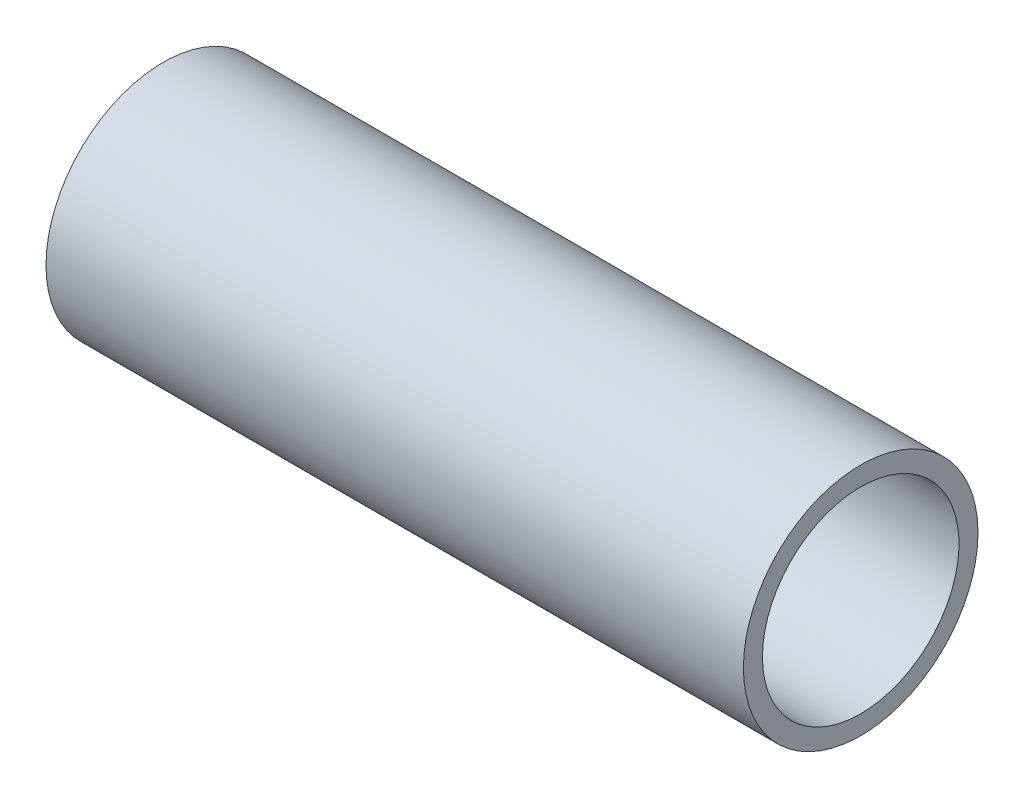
SolidWorks part; units mm, degrees
ref_plane "Plan de face" through (0, 0, 0) normal (0, 0, 1) x (1, 0, 0)
ref_plane "Plan de dessus" through (0, 0, 0) normal (0, 1, 0) x (1, 0, 0)
ref_plane "Plan de droite" through (0, 0, 0) normal (1, 0, 0) x (0, 0, -1)
sketch "Esquisse1" plane through (0, 0, 0) normal (0, 0, 1) x (1, 0, 0)
  line L0 (0, 0) -> (93.571, 0) construction
  line L1 (0, 5) -> (0, 18.5)
  line L2 (0, 18.5) -> (110, 18.5)
  line L3 (110, 18.5) -> (110, 15.5)
  line L4 (110, 15.5) -> (3, 15.5)
  line L5 (3, 15.5) -> (3, 5)
  line L6 (3, 5) -> (0, 5)
  dimension "D1" = 110
  dimension "D2" = 37
  dimension "D3" = 10
  dimension "D4" = 3
revolve "Révolution1" add sketch "Esquisse1" angle 360 about L0
